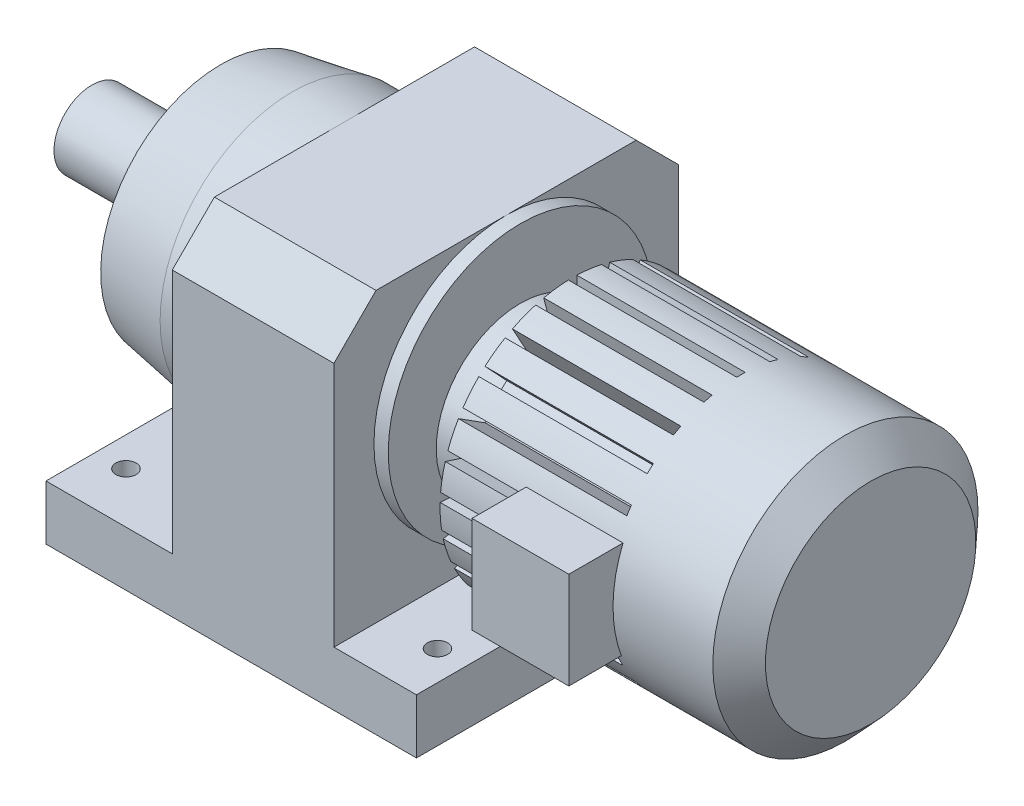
SolidWorks part; units mm, degrees
ref_plane "Front Plane" through (0, 0, 0) normal (0, 0, 1) x (1, 0, 0)
ref_plane "Top Plane" through (0, 0, 0) normal (0, 1, 0) x (1, 0, 0)
ref_plane "Right Plane" through (0, 0, 0) normal (1, 0, 0) x (0, 0, -1)
sketch "Sketch1" plane through (0, 0, 0) normal (0, 0, 1) x (1, 0, 0)
  line L0 (-256.2172, 24.0407) -> (-256.2172, 69.0407)
  line L1 (-256.2172, 69.0407) -> (-113.2172, 69.0407)
  line L2 (-113.2172, 69.0407) -> (-113.2172, 139.0407)
  line L3 (-113.2172, 139.0407) -> (-103.2172, 139.0407)
  line L4 (-103.2172, 139.0407) -> (-103.2172, 166.5917)
  line L5 (-103.2172, 166.5917) -> (-18.2172, 181.0407)
  line L6 (-18.2172, 181.0407) -> (252.7828, 181.0407)
  line L7 (252.7828, 181.0407) -> (252.7828, 24.0407)
  line L13 (252.7828, 24.0407) -> (-256.2172, 24.0407)
  dimension "D1" = 509
  dimension "D2" = 45
  dimension "D3" = 143
  dimension "D4" = 10
  dimension "D5" = 85
  dimension "D6" = 157
  dimension "D7" = 115
revolve "Revolve1" add sketch "Sketch1" angle 360 about L13
sketch "Sketch2" plane through (0, 0, 0) normal (0, 0, 1) x (1, 0, 0)
  line L0 (252.7828, -0.9593) -> (252.7828, 99.0407)
  line L1 (252.7828, -132.9593) -> (252.7828, 181.0407) construction
  line L2 (252.7828, 99.0407) -> (314.7828, 99.0407)
  line L3 (314.7828, 99.0407) -> (314.7828, 156.5407)
  line L4 (314.7828, 156.5407) -> (638.7828, 156.5407)
  line L5 (638.7828, 156.5407) -> (668.7828, 124.0407)
  line L6 (668.7828, 124.0407) -> (668.7828, -0.9593)
  line L7 (668.7828, -0.9593) -> (252.7828, -0.9593)
  line L8 (-256.2172, 24.0407) -> (252.7828, 24.0407) construction
  line L9 (-256.2172, 69.0407) -> (-256.2172, -20.9593) construction
  dimension "D1" = 25
  dimension "D2" = 416
  dimension "D3" = 157.5
  dimension "D4" = 100
  dimension "D5" = 62
  dimension "D6" = 30
  dimension "D7" = 125
revolve "Revolve2" add sketch "Sketch2" angle 360 about L7
sketch "Sketch3" plane through (0, 0, 0) normal (0, 0, 1) x (1, 0, 0)
  line L0 (-256.2172, 69.0407) -> (-256.2172, -20.9593) construction
  line L1 (-106.2172, -225.9593) -> (333.7828, -225.9593)
  line L2 (-106.2172, -225.9593) -> (-106.2172, -160.9593)
  line L3 (-106.2172, -160.9593) -> (43.7828, -160.9593)
  line L4 (333.7828, -225.9593) -> (333.7828, -160.9593)
  line L5 (-256.2172, 24.0407) -> (668.7828, 24.0407) construction
  line L6 (668.7828, -125.9593) -> (668.7828, 124.0407) construction
  line L7 (43.7828, -160.9593) -> (43.7828, 181.0407)
  line L8 (43.7828, 181.0407) -> (235.7828, 181.0407)
  line L9 (235.7828, 181.0407) -> (235.7828, -160.9593)
  line L10 (235.7828, -160.9593) -> (333.7828, -160.9593)
  dimension "D1" = 150
  dimension "D2" = 440
  dimension "D3" = 65
  dimension "D4" = 250
  dimension "D5" = 342
  dimension "D6" = 150
  dimension "D7" = 98
extrude "Boss-Extrude1" add sketch "Sketch3" along normal mid plane 409
sketch "Sketch4" plane through (0, 0, 0) normal (0, 0, 1) x (1, 0, 0)
  line L0 (638.7828, 156.5407) -> (314.7828, 156.5407) construction
  line L1 (314.7828, 156.5407) -> (514.7828, 156.5407)
  line L2 (314.7828, 156.5407) -> (314.7828, 118.7178)
  line L3 (314.7828, 118.7178) -> (514.7828, 118.7178)
  line L4 (514.7828, 156.5407) -> (514.7828, 118.7178)
  line L5 (314.7828, 156.5407) -> (314.7828, -158.4593) construction
  dimension "D1" = 200
extrude "Cut-Extrude1" cut sketch "Sketch4" against normal mid plane 10
pattern_circular "CirPattern1" count 25 over 360 about axis through (0, -0.9593, 0) along (1, 0, 0) of "Cut-Extrude1"
chamfer "Chamfer1" distance 50 angle 45 2 edges at (139.7828, 181.0407, -204.5) (139.7828, 181.0407, 204.5)
sketch "Sketch5" plane through (0, -160.9593, 0) normal (0, 1, 0) x (1, 0, 0)
  line L0 (333.7828, -204.5) -> (333.7828, 204.5) construction
  line L1 (333.7828, -204.5) -> (235.7828, -204.5) construction
  circle A0 centre (298.7828, -144.5) radius 12
  dimension "D1" = 24
  dimension "D2" = 35
  dimension "D3" = 60
extrude "Cut-Extrude2" cut sketch "Sketch5" against normal through all
pattern_linear "LPattern1" count 2 spacing 370 along (-1, 0, 0) count 2 spacing 290 along (0, 0, -1) of "Cut-Extrude2"
ref_plane "Plane1" through (0, 0, 210) normal (0, 0, 1) x (1, 0, 0)
sketch "Sketch7" plane through (0, 0, 210) normal (0, 0, 1) x (1, 0, 0)
  line L0 (314.7828, 1.5651) -> (514.7828, 1.5651) construction
  line L1 (405.2828, -55.9349) -> (520.2828, -55.9349)
  line L2 (405.2828, -55.9349) -> (405.2828, 59.0651)
  line L3 (405.2828, 59.0651) -> (520.2828, 59.0651)
  line L4 (520.2828, -55.9349) -> (520.2828, 59.0651)
  line L5 (405.2828, -55.9349) -> (520.2828, 59.0651) construction
  line L6 (405.2828, 59.0651) -> (520.2828, -55.9349) construction
  line L7 (462.7828, 1.5651) -> (0, 0) construction
  line L8 (668.7828, -125.9593) -> (668.7828, 124.0407) construction
  point P0 (462.7828, 1.5651)
  dimension "D1" = 115
  dimension "D2" = 206
  dimension "D3" = 115
extrude "Boss-Extrude2" add sketch "Sketch7" against normal up to surface (62.4062 mm away)
